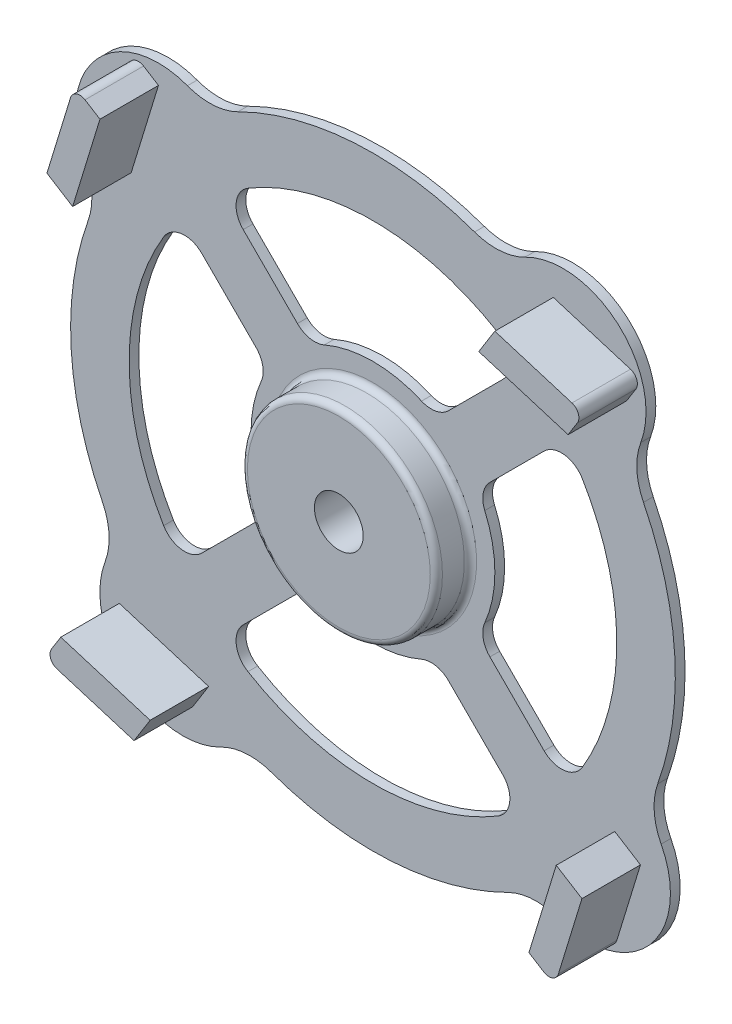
SolidWorks part; units mm, degrees
ref_plane "Спереди" through (0, 0, 0) normal (0, 0, 1) x (1, 0, 0)
ref_plane "Сверху" through (0, 0, 0) normal (0, 1, 0) x (1, 0, 0)
ref_plane "Справа" through (0, 0, 0) normal (1, 0, 0) x (0, 0, -1)
sketch "Эскиз1" plane through (0, 0, 0) normal (0, 0, 1) x (1, 0, 0)
  line L0 (0, 0) -> (43.8406, 43.8406) construction
  line L1 (62, 0) -> (0, 0) construction
  line L2 (0, 0) -> (0, 62) construction
  line L3 (15.4931, 23.9784) -> (26.6119, 35.0971)
  line L4 (-15.4931, 23.9784) -> (-26.6119, 35.0971)
  line L5 (23.9784, -15.4931) -> (35.0971, -26.6119)
  line L6 (23.9784, 15.4931) -> (35.0971, 26.6119)
  line L7 (-15.4931, -23.9784) -> (-26.6119, -35.0971)
  line L8 (15.4931, -23.9784) -> (26.6119, -35.0971)
  line L9 (-23.9784, 15.4931) -> (-35.0971, 26.6119)
  line L10 (-23.9784, -15.4931) -> (-35.0971, -26.6119)
  line L11 (0, 0) -> (18.127, 59.2909) construction
  line L12 (0, 0) -> (-62, 0) construction
  line L13 (0, 0) -> (-52.579, 32.855) construction
  line L15 (0, 0) -> (-44, 0) construction
  line L16 (0, 0) -> (0, 39) construction
  line L17 (0, 39) -> (-44, 39) construction
  line L18 (-44, 0) -> (-44, 39) construction
  circle A0 centre (0, 0) radius 5
  arc A1 (15.4931, 23.9784) -> (9.9646, 22.9283) centre (11.9576, 27.5139) cw
  arc A2 (-38.05, 54.9248) -> (-59.0953, 31.1813) centre (-44, 39) ccw
  arc A3 (25.6404, 42.9252) -> (-25.6404, 42.9252) centre (0, 0) ccw
  arc A4 (-59.0953, 31.1813) -> (-58.3947, 20.834) centre (-70.6388, 25.2024) cw
  arc A5 (26.6119, 35.0971) -> (25.6404, 42.9252) centre (23.0763, 38.6327) ccw
  arc A6 (-26.6119, 35.0971) -> (-25.6404, 42.9252) centre (-23.0763, 38.6327) cw
  arc A7 (9.9646, 22.9283) -> (-9.9646, 22.9283) centre (0, 0) ccw
  arc A8 (-15.4931, 23.9784) -> (-9.9646, 22.9283) centre (-11.9576, 27.5139) ccw
  arc A9 (23.9784, -15.4931) -> (22.9283, -9.9646) centre (27.5139, -11.9576) cw
  arc A10 (42.9252, -25.6404) -> (42.9252, 25.6404) centre (0, 0) ccw
  arc A11 (35.0971, -26.6119) -> (42.9252, -25.6404) centre (38.6327, -23.0763) ccw
  arc A12 (35.0971, 26.6119) -> (42.9252, 25.6404) centre (38.6327, 23.0763) cw
  arc A13 (22.9283, -9.9646) -> (22.9283, 9.9646) centre (0, 0) ccw
  arc A14 (23.9784, 15.4931) -> (22.9283, 9.9646) centre (27.5139, 11.9576) ccw
  arc A15 (-15.4931, -23.9784) -> (-9.9646, -22.9283) centre (-11.9576, -27.5139) cw
  arc A16 (-25.6404, -42.9252) -> (25.6404, -42.9252) centre (0, 0) ccw
  arc A17 (-26.6119, -35.0971) -> (-25.6404, -42.9252) centre (-23.0763, -38.6327) ccw
  arc A18 (26.6119, -35.0971) -> (25.6404, -42.9252) centre (23.0763, -38.6327) cw
  arc A19 (-9.9646, -22.9283) -> (9.9646, -22.9283) centre (0, 0) ccw
  arc A20 (15.4931, -23.9784) -> (9.9646, -22.9283) centre (11.9576, -27.5139) ccw
  arc A21 (-23.9784, 15.4931) -> (-22.9283, 9.9646) centre (-27.5139, 11.9576) cw
  arc A22 (-42.9252, 25.6404) -> (-42.9252, -25.6404) centre (0, 0) ccw
  arc A23 (-35.0971, 26.6119) -> (-42.9252, 25.6404) centre (-38.6327, 23.0763) ccw
  arc A24 (-35.0971, -26.6119) -> (-42.9252, -25.6404) centre (-38.6327, -23.0763) cw
  arc A25 (-22.9283, 9.9646) -> (-22.9283, -9.9646) centre (0, 0) ccw
  arc A26 (-23.9784, -15.4931) -> (-22.9283, -9.9646) centre (-27.5139, -11.9576) ccw
  arc A27 (-58.3947, 20.834) -> (-55.4714, -27.6934) centre (0, 0) ccw
  arc A28 (-27.6934, 55.4714) -> (-38.05, 54.9248) centre (-33.5, 67.1025) cw
  arc A29 (31.1813, 59.0953) -> (20.834, 58.3947) centre (25.2024, 70.6388) cw
  arc A30 (54.9248, 38.05) -> (31.1813, 59.0953) centre (39, 44) ccw
  arc A31 (55.4714, 27.6934) -> (54.9248, 38.05) centre (67.1025, 33.5) cw
  arc A32 (59.0953, -31.1813) -> (58.3947, -20.834) centre (70.6388, -25.2024) cw
  arc A33 (38.05, -54.9248) -> (59.0953, -31.1813) centre (44, -39) ccw
  arc A34 (27.6934, -55.4714) -> (38.05, -54.9248) centre (33.5, -67.1025) cw
  arc A35 (-31.1813, -59.0953) -> (-20.834, -58.3947) centre (-25.2024, -70.6388) cw
  arc A36 (-54.9248, -38.05) -> (-31.1813, -59.0953) centre (-39, -44) ccw
  arc A37 (-55.4714, -27.6934) -> (-54.9248, -38.05) centre (-67.1025, -33.5) cw
  arc A38 (20.834, 58.3947) -> (-27.6934, 55.4714) centre (0, 0) ccw
  arc A39 (58.3947, -20.834) -> (55.4714, 27.6934) centre (0, 0) ccw
  arc A40 (-20.834, -58.3947) -> (27.6934, -55.4714) centre (0, 0) ccw
  point P16 (30.8572, 39.3425)
  point P19 (-30.8572, 39.3425)
  point P21 (12.9184, 21.4036)
  point P24 (-12.9184, 21.4036)
  dimension "D1" = 10
  dimension "D2" = 25
  dimension "D3" = 124
  dimension "D7" = 5
  dimension "D8" = 5
  dimension "D12" = 44
  dimension "D13" = 39
  dimension "D4" = 50
  dimension "D14" = 34
  dimension "D15" = 13
  dimension "D5" = 45
  dimension "D6" = 6
  dimension "D10" = 17
  dimension "D11" = 32
  dimension "D9" = 4
extrude "Бобышка-Вытянуть1" add sketch "Эскиз1" along normal blind 2
sketch "Эскиз5" plane through (0, 0, 2) normal (0, 0, 1) x (1, 0, 0)
  line L0 (0, 0) -> (-52.579, 32.855) construction
  line L1 (0, 0) -> (18.127, 59.2909) construction
  line L2 (0, 0) -> (-52.579, 32.855) construction
  line L3 (0, 0) -> (18.127, 59.2909) construction
  line L4 (-54.8526, 36.9878) -> (-49.5848, 33.6961)
  line L5 (-49.5848, 33.6961) -> (-43.9851, 52.0119)
  line L6 (-54.8526, 36.9878) -> (-50.015, 52.811)
  line L7 (-47.0425, 53.9223) -> (-43.9851, 52.0119)
  line L8 (36.9878, 54.8526) -> (33.6961, 49.5848)
  line L9 (33.6961, 49.5848) -> (52.0119, 43.9851)
  line L10 (36.9878, 54.8526) -> (52.811, 50.015)
  line L11 (53.9223, 47.0425) -> (52.0119, 43.9851)
  line L12 (54.8526, -36.9878) -> (49.5848, -33.6961)
  line L13 (49.5848, -33.6961) -> (43.9851, -52.0119)
  line L14 (54.8526, -36.9878) -> (50.015, -52.811)
  line L15 (47.0425, -53.9223) -> (43.9851, -52.0119)
  line L16 (-36.9878, -54.8526) -> (-33.6961, -49.5848)
  line L17 (-33.6961, -49.5848) -> (-52.0119, -43.9851)
  line L18 (-36.9878, -54.8526) -> (-52.811, -50.015)
  line L19 (-53.9223, -47.0425) -> (-52.0119, -43.9851)
  arc A0 (-50.015, 52.811) -> (-47.0425, 53.9223) centre (-48.1024, 52.2262) cw
  arc A1 (52.811, 50.015) -> (53.9223, 47.0425) centre (52.2262, 48.1024) cw
  arc A2 (50.015, -52.811) -> (47.0425, -53.9223) centre (48.1024, -52.2262) cw
  arc A3 (-52.811, -50.015) -> (-53.9223, -47.0425) centre (-52.2262, -48.1024) cw
  dimension "D6" = 2
  dimension "D1" = 75
  dimension "D2" = 2.3
  dimension "D3" = 57.27
  dimension "D4" = 6
  dimension "D5" = 18.5
extrude "Бобышка-Вытянуть5" add sketch "Эскиз5" along normal blind 12
sketch "Эскиз6" plane through (0, 0, 2) normal (0, 0, 1) x (1, 0, 0)
  circle A0 centre (0, 0) radius 20
  circle A1 centre (0, 0) radius 5 construction
  circle A2 centre (0, 0) radius 5
  dimension "D1" = 40
extrude "Бобышка-Вытянуть6" add sketch "Эскиз6" along normal blind 7
sketch "Эскиз7" plane through (0, 0, 0) normal (0, 0, -1) x (-1, 0, 0)
  circle A0 centre (0, 0) radius 15
  circle A1 centre (0, 0) radius 5 construction
  circle A2 centre (0, 0) radius 5
  dimension "D1" = 30
extrude "Бобышка-Вытянуть7" add sketch "Эскиз7" along normal blind 1
fillet "Скругление1" radius 1.25 2 edges at (-20, 0, 2) (20, 0, 9)
